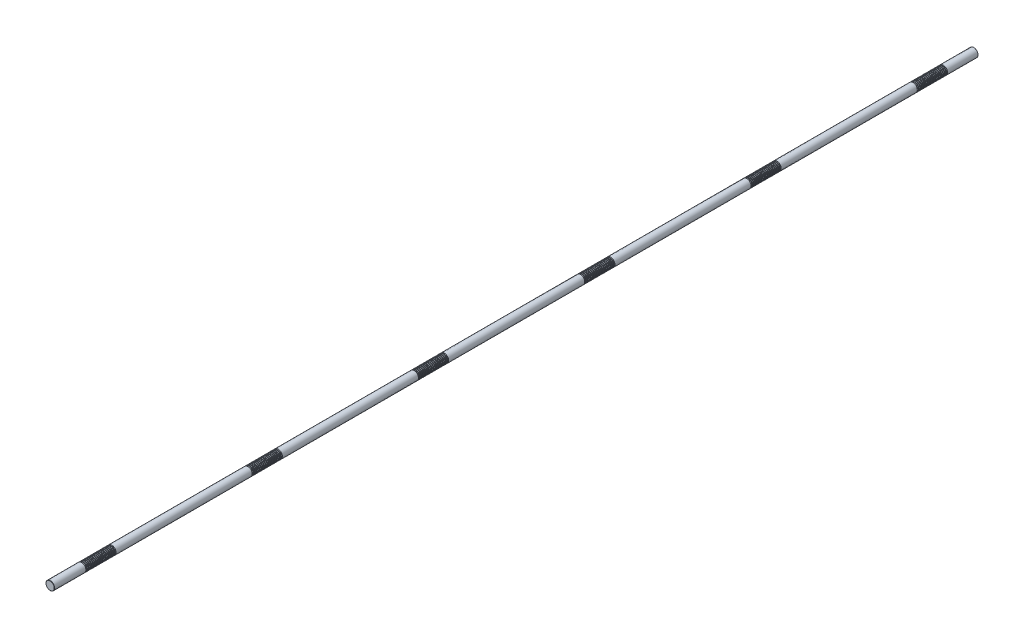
SolidWorks part; units mm, degrees
ref_plane "Front Plane" through (0, 0, 0) normal (0, 0, 1) x (1, 0, 0)
ref_plane "Top Plane" through (0, 0, 0) normal (0, 1, 0) x (1, 0, 0)
ref_plane "Right Plane" through (0, 0, 0) normal (1, 0, 0) x (0, 0, -1)
sketch "Sketch1" plane through (0, 0, 0) normal (0, 0, 1) x (1, 0, 0)
  circle A0 centre (0, 0) radius 14
  dimension "D1" = 28
extrude "Boss-Extrude1" add sketch "Sketch1" along normal mid plane 3000
chamfer "Chamfer1" distance 0.7 angle 45 2 edges at (14, 0, -1500) (14, 0, 1500)
sketch "Sketch2" plane through (0, 0, 0) normal (1, 0, 0) x (0, 0, -1)
  line L0 (1400.3684, 14) -> (1397.1316, 14)
  line L1 (1499.3, 14) -> (-1499.3, 14) construction
  line L2 (1397.1316, 14) -> (1397.8684, 11.25)
  line L3 (1397.8684, 11.25) -> (1399.6316, 11.25)
  line L4 (1399.6316, 11.25) -> (1400.3684, 14)
  line L5 (1500, -13.3) -> (1500, 13.3) construction
  point P4 (1398.75, 14)
  point P7 (1398.75, 11.25)
  point P8 (1400, 12.625)
  point P9 (1397.5, 12.625)
  dimension "D1" = 2.5
  dimension "D2" = 100
  dimension "D3" = 2.75
  dimension "D4" = 30
revolve "Cut-Revolve1" cut sketch "Sketch2" angle 360 about axis through (0, 0, 1500) along (0, 0, -1)
pattern_linear "LPattern1" count 20 spacing 5 along (0, 0, 1) of "Cut-Revolve1"
pattern_linear "LPattern2" count 6 spacing 540 along (0, 0, 1) of "Cut-Revolve1", "LPattern1"
